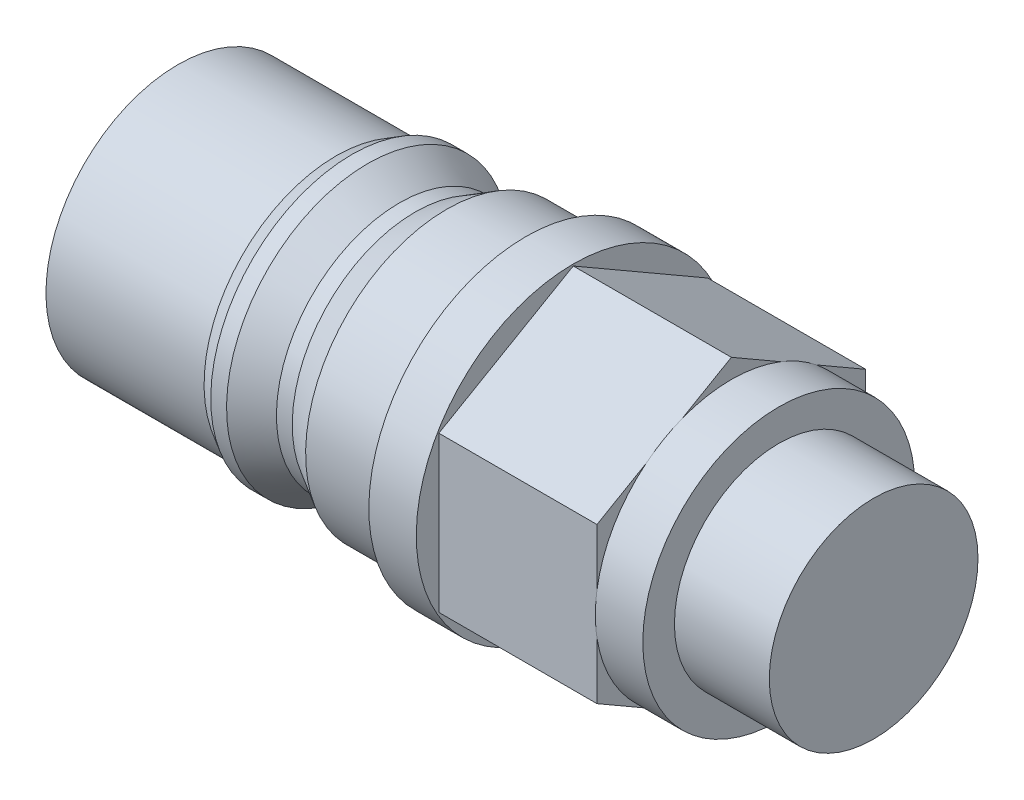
SolidWorks part; units mm, degrees
ref_plane "Alzado" through (0, 0, 0) normal (0, 0, 1) x (1, 0, 0)
ref_plane "Planta" through (0, 0, 0) normal (0, 1, 0) x (1, 0, 0)
ref_plane "Vista lateral" through (0, 0, 0) normal (1, 0, 0) x (0, 0, -1)
sketch "Croquis1" plane through (0, 0, 0) normal (0, 0, 1) x (1, 0, 0)
  line L0 (0, 0) -> (25, 0) construction
  line L1 (0, 0) -> (0, 8.35)
  line L2 (0, 8.35) -> (10, 8.35)
  line L3 (10, 8.35) -> (11, 8.9274)
  line L4 (11, 8.9274) -> (12, 8.9274)
  line L5 (11.5, 8.9274) -> (11.5, 0) construction
  line L6 (13, 8.35) -> (12, 8.9274)
  line L7 (13, 8.35) -> (14, 7.7726)
  line L8 (14, 7.7726) -> (15, 7.7726)
  line L9 (14.5, 7.7726) -> (14.5, 0) construction
  line L10 (16, 8.35) -> (15, 7.7726)
  line L11 (16, 8.35) -> (17, 8.9274)
  line L12 (17, 8.9274) -> (22, 8.9274)
  line L14 (25, 0) -> (0, 0)
  line L15 (22, 8.9274) -> (22, 9.9274)
  line L16 (22, 9.9274) -> (25, 9.9274)
  line L17 (25, 9.9274) -> (25, 0)
  point P18 (27.5743, 0)
  dimension "D1" = 16.7
  dimension "D2" = 10
  dimension "D3" = 1
  dimension "D4" = 1
  dimension "D5" = 150
  dimension "D6" = 1
  dimension "D7" = 1
  dimension "D8" = 5
  dimension "D9" = 1
  dimension "D10" = 3
revolve "Revolución1" add sketch "Croquis1" angle 360 about L14
sketch "Croquis8" plane through (25, 0, 0) normal (1, 0, 0) x (0, 0, -1)
  line L1 (0, 9.815) -> (-8.5, 4.9075)
  line L2 (-8.5, 4.9075) -> (-8.5, -4.9075)
  line L3 (-8.5, -4.9075) -> (0, -9.815)
  line L4 (0, -9.815) -> (8.5, -4.9075)
  line L5 (8.5, -4.9075) -> (8.5, 4.9075)
  line L6 (8.5, 4.9075) -> (0, 9.815)
  circle A0 centre (0, 0) radius 8.5 construction
  dimension "D1" = 17
extrude "Saliente-Extruir6" add sketch "Croquis8" along normal blind 10
sketch "Croquis10" plane through (0, 0, 0) normal (0, 0, 1) x (1, 0, 0)
  line L0 (35, 0) -> (44, 0) construction
  line L1 (35, 4.9075) -> (35, -4.9075) construction
  line L2 (44, 0) -> (44, 6.6)
  line L3 (44, 6.6) -> (38, 6.6)
  line L4 (38, 6.6) -> (38, 8.6)
  line L5 (38, 8.6) -> (35, 8.6)
  line L6 (35, 8.6) -> (35, 0)
  line L7 (35, 0) -> (44, 0)
  line L8 (35, 0) -> (108.8542, 0) construction
  dimension "D1" = 9
  dimension "D2" = 3
  dimension "D3" = 13.2
  dimension "D4" = 2
revolve "Revolución3" add sketch "Croquis10" angle 360 about L8
